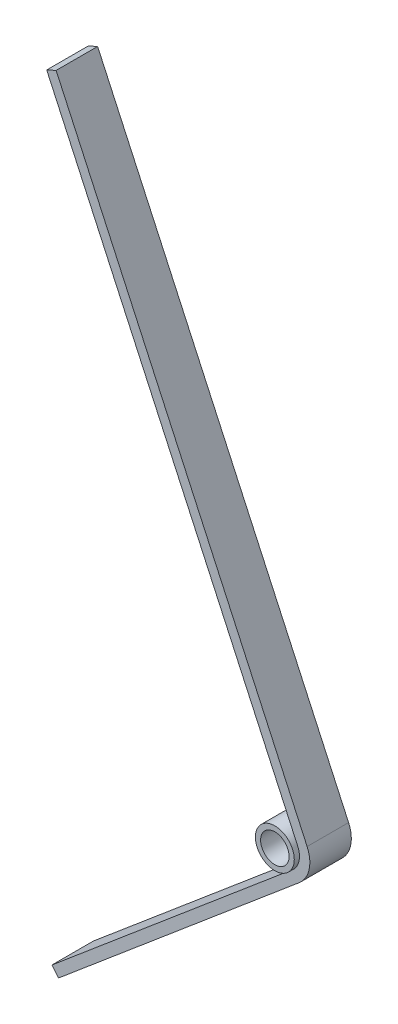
SolidWorks part; units mm, degrees
ref_plane "Front Plane" through (0, 0, 0) normal (0, 0, 1) x (1, 0, 0)
ref_plane "Top Plane" through (0, 0, 0) normal (0, 1, 0) x (1, 0, 0)
ref_plane "Right Plane" through (0, 0, 0) normal (1, 0, 0) x (0, 0, -1)
sketch "Sketch1" plane through (0, 0, 0) normal (0, 0, 1) x (1, 0, 0)
  circle A0 centre (0, 0) radius 8.7312
  circle A1 centre (0, 0) radius 11.9062
  circle A2 centre (0, 0) radius 7.9375 construction
  dimension "D1" = 17.4625
  dimension "D2" = 3.175
  dimension "D3" = 15.875
extrude "Extrude1" add sketch "Sketch1" along normal mid plane 31.75
sketch "Sketch2" plane through (0, 0, 0) normal (0, 0, 1) x (1, 0, 0)
  line L0 (10.8203, 4.9679) -> (-142.875, 339.725)
  line L1 (-139.7, 111.125) -> (-139.7, -136.525) construction
  line L2 (7.6744, -9.1029) -> (-139.7, -133.35)
  line L3 (-146.05, -142.875) -> (-342.9, -142.875) construction
  line L4 (-142.875, -134.9375) -> (-142.875, 874.2104) construction
  circle A0 centre (0, 0) radius 11.9062 construction
  arc A1 (7.6744, -9.1029) -> (10.8203, 4.9679) centre (0, 0) ccw
  dimension "D1" = 9.525
  dimension "D2" = 473.075
extrude "Extrude-Thin1" add sketch "Sketch2" along normal mid plane 25.4 thin
